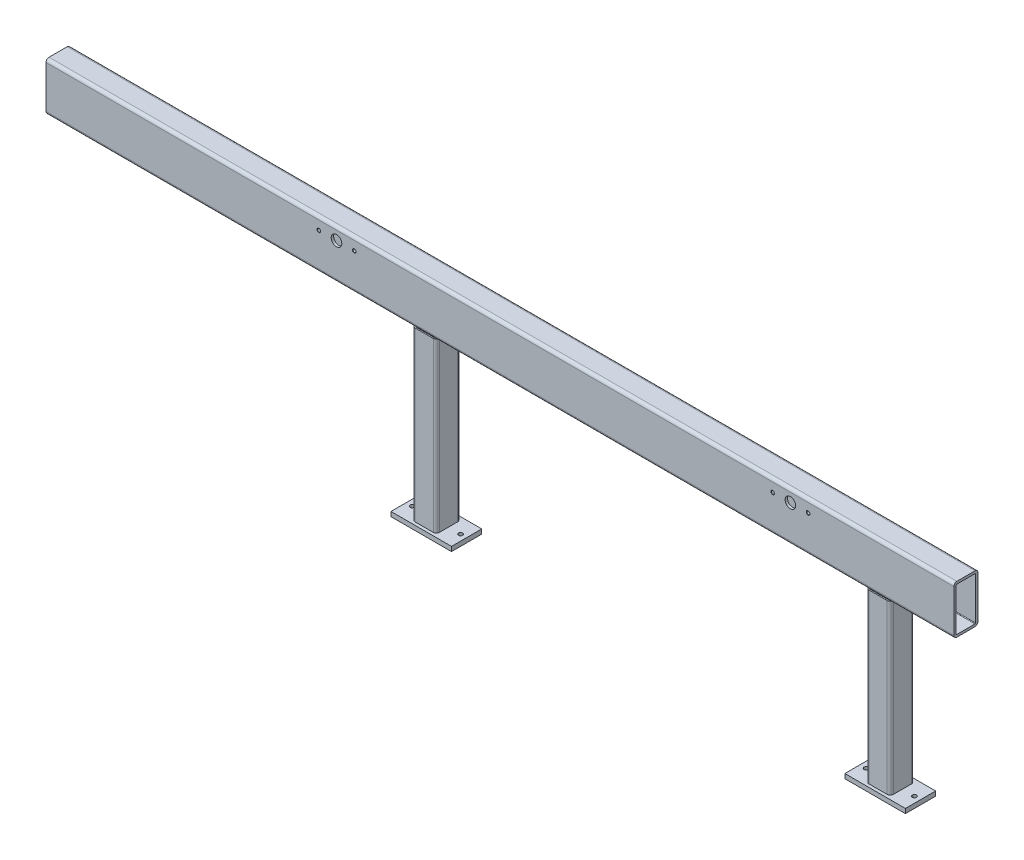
SolidWorks part; units mm, degrees
ref_plane "Ebene vorne" through (0, 0, 0) normal (0, 0, 1) x (1, 0, 0)
ref_plane "Ebene oben" through (0, 0, 0) normal (0, 1, 0) x (1, 0, 0)
ref_plane "Ebene rechts" through (0, 0, 0) normal (1, 0, 0) x (0, 0, -1)
sketch "Skizze1" plane through (0, 0, 0) normal (0, 0, 1) x (1, 0, 0)
  line L0 (-3000, 0) -> (0, 0)
  line L1 (-250, -730) -> (-250, 0)
  dimension "D1" = 3000
  dimension "D3" = 730
  dimension "D4" = 250
other "Strukturbauteil1"
ref_plane "Ebene1" through (-3000, 0, 0) normal (1, 0, 0) x (0, 0, -1)
sketch "Skizze117" plane through (-3000, 0, 0) normal (1, 0, 0) x (0, 0, -1)
  line L0 (0, 338.974) -> (0, -351.6808) construction
  line L1 (-355.0444, 0) -> (350.5596, 0) construction
  line L2 (32, 70) -> (32, -70)
  line L3 (-30, 80) -> (30, 80)
  line L4 (-40, 70) -> (-40, -70)
  line L5 (-30, -80) -> (30, -80)
  line L6 (40, 70) -> (40, -70)
  line L7 (-30, -72) -> (30, -72)
  line L8 (-32, 70) -> (-32, -70)
  line L9 (-30, 72) -> (30, 72)
  arc A0 (30, 80) -> (40, 70) centre (30, 70) cw
  arc A1 (-30, 80) -> (-40, 70) centre (-30, 70) ccw
  arc A2 (-40, -70) -> (-30, -80) centre (-30, -70) ccw
  arc A3 (30, -80) -> (40, -70) centre (30, -70) ccw
  arc A4 (30, -72) -> (32, -70) centre (30, -70) ccw
  arc A5 (-32, -70) -> (-30, -72) centre (-30, -70) ccw
  arc A6 (-30, 72) -> (-32, 70) centre (-30, 70) ccw
  arc A7 (30, 72) -> (32, 70) centre (30, 70) cw
  point P13 (0, 80)
  point P14 (-40, 0)
  point P15 (0, -80)
  point P16 (40, 0)
  point P17 (-40, 80)
  point P20 (-40, -80)
  point P35 (40, -80)
  point P36 (40, 80)
  point P37 (0, 0)
  dimension "R" = 10
  dimension "D1" = 80
  dimension "A" = 160
  dimension "t" = 8
other "Strukturbauteil4"
ref_plane "Ebene5" through (-250, -730, 0) normal (0, 1, 0) x (-1, 0, 0)
sketch "Skizze118" plane through (-250, -730, 0) normal (0, 1, 0) x (-1, 0, 0)
  line L0 (0, 338.974) -> (0, -351.6808) construction
  line L1 (-355.0444, 0) -> (350.5596, 0) construction
  line L2 (36, 30) -> (36, -30)
  line L3 (-30, 40) -> (30, 40)
  line L4 (-40, 30) -> (-40, -30)
  line L5 (-30, -40) -> (30, -40)
  line L6 (40, 30) -> (40, -30)
  line L7 (-30, -36) -> (30, -36)
  line L8 (-36, 30) -> (-36, -30)
  line L9 (-30, 36) -> (30, 36)
  arc A0 (30, 40) -> (40, 30) centre (30, 30) cw
  arc A1 (-30, 40) -> (-40, 30) centre (-30, 30) ccw
  arc A2 (-40, -30) -> (-30, -40) centre (-30, -30) ccw
  arc A3 (30, -40) -> (40, -30) centre (30, -30) ccw
  arc A4 (30, -36) -> (36, -30) centre (30, -30) ccw
  arc A5 (-36, -30) -> (-30, -36) centre (-30, -30) ccw
  arc A6 (-30, 36) -> (-36, 30) centre (-30, 30) ccw
  arc A7 (30, 36) -> (36, 30) centre (30, 30) cw
  point P13 (0, 40)
  point P14 (-40, 0)
  point P15 (0, -40)
  point P16 (40, 0)
  point P17 (-40, 40)
  point P20 (-40, -40)
  point P35 (40, -40)
  point P36 (40, 40)
  point P37 (0, 0)
  dimension "R" = 10
  dimension "A" = 80
  dimension "t" = 4
sketch "Skizze12" plane through (0, 0, -40) normal (0, 0, 1) x (1, 0, 0)
  line L0 (0, -150) -> (0, -10) construction
  line L1 (0, 0) -> (-3000, 0) construction
  circle A0 centre (-540, -40) radius 17.5
  dimension "D2" = 35
  dimension "D1" = 540
  dimension "D3" = 40
extrude "Schnitt-Linear austragen1" cut sketch "Skizze12" along normal through all
hole_wizard "M12 Gewindebohrung1" positions "3D-Skizze2" profile "Skizze137" tap size "M12" standard "DIN"
sketch3d "3D-Skizze2"
  circle A2 centre (-598.5, -40, -59) radius 8 construction
  circle A3 centre (-481.5, -40, -59) radius 8 construction
  point P13 (-598.5, -40, -40)
  point P15 (-481.5, -40, -40)
  point P20 (-598.5, -40, -67)
  point P24 (-481.5, -40, -67)
sketch "Skizze137" plane through (-598.5, -40, -40) normal (1, 0, 0) x (0, 1, 0)
  line L0 (0, 0) -> (0, 8.001)
  line L1 (0, 8.001) -> (5.1, 8.001)
  line L2 (5.1, 8.001) -> (5.1, 0.925)
  line L3 (5.1, 0.925) -> (6.025, 0)
  line L5 (6.025, 0) -> (0, 0)
  line L6 (-5.1, 0.925) -> (-6.025, 0) construction
  line L11 (0, -6.35) -> (0, 107.95) construction
  dimension "Bohrerdurchmesser" = 10.2
  dimension "Bohrungstiefe" = 8.001
  dimension "Senkdurchmesser (Oben)" = 12.05
  dimension "Senkwinkel (Oben)" = 90
mirror "Spiegeln1" about plane through (0, 0, 0) normal (0, 0, 1) of "M12 Gewindebohrung1"
pattern_linear "Lineares Muster1" count 2 spacing 1500 along (-1, 0, 0) of "Schnitt-Linear austragen1", "Spiegeln1", "M12 Gewindebohrung1"
sketch "Skizze16" plane through (0, -730, 0) normal (0, -1, 0) x (1, 0, 0)
  line L1 (-150, 50) -> (-150, -50)
  line L2 (-150, 50) -> (-350, 50)
  line L3 (-350, 50) -> (-350, -50)
  line L4 (-150, -50) -> (-350, -50)
  line L6 (-210, 0) -> (-150, 0) construction
  line L7 (-210, 30) -> (-210, -30) construction
  line L8 (-250, 50) -> (-250, 40) construction
  line L9 (-280, 40) -> (-220, 40) construction
  dimension "D1" = 100
  dimension "D2" = 60
extrude "Linear austragen1" add sketch "Skizze16" against normal blind 15 separate body
other "Trimmen/Verlängern1"
hole_wizard "Ø13.5 (13.5) Durchmesser Bohrung1" positions "Skizze18" profile "Skizze17" hole size "Ø13.5" standard "ISO"
sketch "Skizze18" plane through (0, -730, 0) normal (0, -1, 0) x (1, 0, 0)
  line L7 (-150, 0) -> (-170, 0) construction
  line L8 (-150, -50) -> (-150, 50) construction
  line L9 (-170, 0) -> (-330, 0) construction
  line L10 (-330, 0) -> (-350, 0) construction
  line L11 (-350, 50) -> (-350, -50) construction
  point P0 (-330, 0)
  point P1 (-170, 0)
  dimension "D1" = 20
sketch "Skizze17" plane through (-330, -730, 0) normal (1, 0, 0) x (0, 0, -1)
  line L0 (0, 0) -> (0, 570.0558)
  line L1 (0, 570.0558) -> (6.75, 566)
  line L2 (6.75, 566) -> (6.75, 0)
  line L5 (6.75, 0) -> (0, 0)
  line L10 (0, 570.0558) -> (-6.75, 566) construction
  line L11 (0, -6.35) -> (0, 107.95) construction
  dimension "Bohrerdurchmesser" = 13.5
  dimension "Bohrungstiefe" = 566
  dimension "Spitzenwinkel" = 118
pattern_linear "Lineares Muster2" count 2 spacing 1500 along (-1, 0, 0)
ref_plane "Ebene2" through (-250, 0, 0) normal (1, 0, 0) x (0, 0, -1)
sketch "Skizze19" plane through (-250, 0, 0) normal (1, 0, 0) x (0, 0, -1)
  line L0 (50, 29.1062) -> (-189.4431, -13.1141)
  line L1 (-189.4431, -13.1141) -> (-340, -575)
  line L2 (-140, -575) -> (-1140, -575)
  line L3 (-640, -1075) -> (-640, 25)
  line L4 (-30, 0) -> (-30, 15) construction
  line L5 (50, -730) -> (-50, -730) construction
  line L6 (-140, -800) -> (-140, -618.6799) construction
  line L7 (30, 0) -> (-30, 0) construction
  line L8 (-340, -575) -> (-340, -730) construction
  line L9 (-1140, -840.5264) -> (-1140, -618.6799) construction
  line L10 (-1023.7938, -1075) -> (0, -1075) construction
  line L11 (40, -150) -> (40, -10) construction
  line L13 (-40, -10) -> (-40, -150) construction
  dimension "D1" = 15
  dimension "D2" = 10
  dimension "D3" = 10
  dimension "D4" = 600
  dimension "D5" = 600
  dimension "D6" = 155
  dimension "D7" = 115
  dimension "D8" = 300
  dimension "D9" = 500
  dimension "D10" = 500
  dimension "D11" = 500
ref_plane "Ebene19" through (0, -100, 0) normal (0, 1, 0) x (-1, 0, 0)
